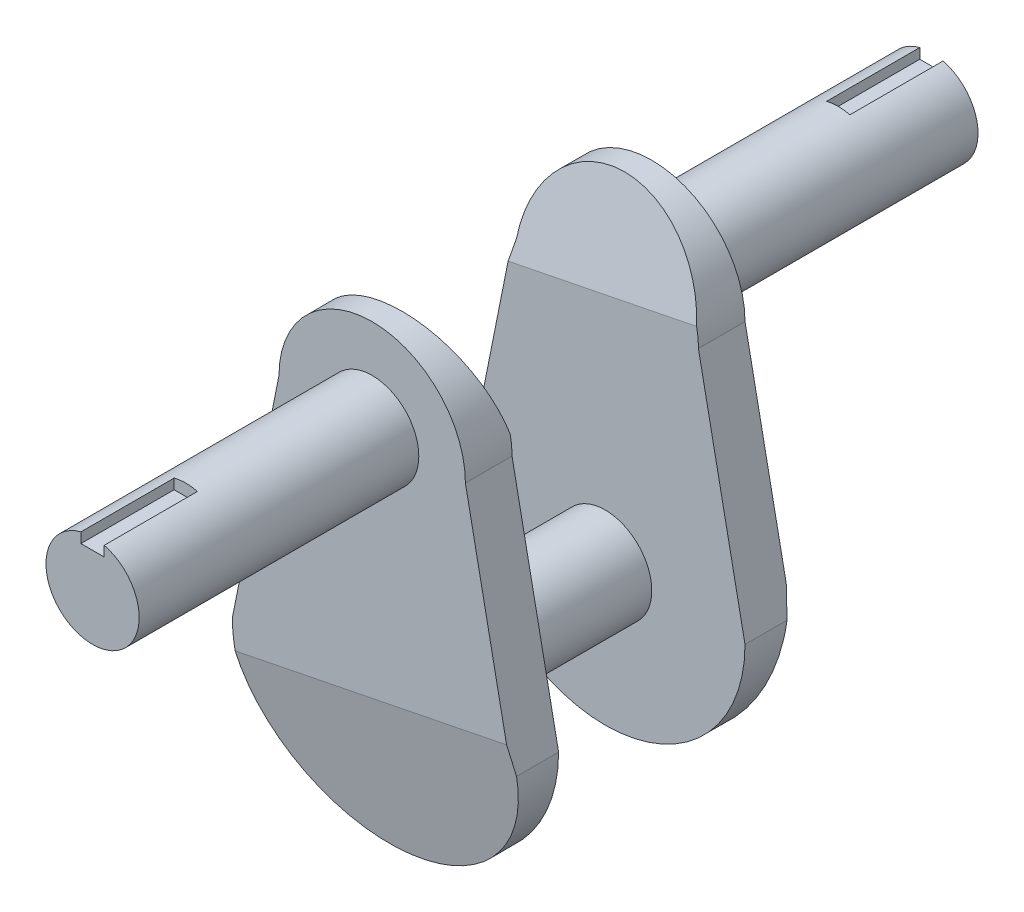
SolidWorks part; units mm, degrees
other "Markup1"
sketch "Sketch19" plane through (-38.1, 88.9, -114.3) normal (-0.7048, 0.0144, -0.7093) x (-0.7094, -0.0113, 0.7047)
ref_plane "Front Plane" through (0, 0, 0) normal (0, 0, 1) x (1, 0, 0)
ref_plane "Top Plane" through (0, 0, 0) normal (0, 1, 0) x (1, 0, 0)
ref_plane "Right Plane" through (0, 0, 0) normal (1, 0, 0) x (0, 0, -1)
sketch "Sketch1" plane through (0, 0, 0) normal (0, 0, 1) x (1, 0, 0)
  circle A0 centre (0, 0) radius 12.7
  dimension "D1" = 25.4
extrude "Boss-Extrude1" add sketch "Sketch1" along normal blind 25.4
sketch "Sketch3" plane through (0, 0, 25.4) normal (0, 0, 1) x (1, 0, 0)
  line L0 (-25.4, 63.5) -> (-38.1, 0)
  line L1 (25.4, 63.5) -> (38.1, 0)
  arc A0 (-38.1, 0) -> (38.1, 0) centre (0, 0) ccw
  arc A1 (25.4, 63.5) -> (-25.4, 63.5) centre (0, 63.5) ccw
  dimension "D1" = 76.2
  dimension "D2" = 50.8
  dimension "D3" = 63.5
extrude "Boss-Extrude2" add sketch "Sketch3" along normal blind 12.7
sketch "Sketch5" plane through (0, 0, 38.1) normal (0, 0, 1) x (1, 0, 0)
  circle A0 centre (0, 63.5) radius 12.7
  arc A1 (25.4, 63.5) -> (-25.4, 63.5) centre (0, 63.5) ccw construction
  point P5 (0, 88.9)
  dimension "D1" = 25.4
  dimension "D2" = 25.4
extrude "Boss-Extrude3" add sketch "Sketch5" along normal blind 76.2
sketch "Sketch7" plane through (36.6346, 7.3269, 0) normal (0.9806, 0.1961, 0) x (0, 0, -1)
  line L0 (-38.1, -7.472) -> (-38.1, 57.2855) construction
  line L1 (-38.1, -38.1) -> (-25.4, -38.1) construction
  line L2 (-38.1, 0) -> (-31.75, -38.1)
  arc A0 (-38.1, 0) -> (-31.75, -38.1) centre (-34.925, -19.05) ccw
extrude "Cut-Extrude1" cut sketch "Sketch7" against normal through all
sketch "Sketch8" plane through (36.6346, 7.3269, 0) normal (0.9806, 0.1961, 0) x (0, 0, -1)
  line L0 (-25.4, 57.2855) -> (-25.4, 87.6669) construction
  line L1 (-25.4, 87.6669) -> (-38.1, 87.6669) construction
  line L2 (-31.75, 87.6669) -> (-25.4, 62.2669)
  arc A0 (-25.4, 62.2669) -> (-31.75, 87.6669) centre (-28.575, 74.9669) ccw
extrude "Cut-Extrude3" cut sketch "Sketch8" against normal through all and the other way through all
sketch "Sketch12" plane through (0, 0, 0) normal (0, 0, -1) x (-1, 0, 0)
  circle A0 centre (0, 0) radius 12.7
  dimension "D1" = 25.4
extrude "Boss-Extrude4" add sketch "Sketch12" along normal blind 25.4
sketch "Sketch13" plane through (0, 0, -25.4) normal (0, 0, -1) x (-1, 0, 0)
  line L0 (-25.4, 63.5) -> (-38.1, 0)
  line L1 (25.4, 63.5) -> (38.1, 0)
  arc A1 (25.4, 63.5) -> (-25.4, 63.5) centre (0, 63.5) ccw
  arc A2 (-38.1, 0) -> (38.1, 0) centre (0, 0) ccw
  dimension "D2" = 50.8
  dimension "D3" = 63.5
extrude "Boss-Extrude6" add sketch "Sketch13" along normal blind 12.7
sketch "Sketch14" plane through (0, 0, -38.1) normal (0, 0, -1) x (-1, 0, 0)
  circle A0 centre (0, 63.5) radius 12.7
  arc A1 (25.4, 63.5) -> (-25.4, 63.5) centre (0, 63.5) ccw construction
  point P5 (0, 88.9)
  dimension "D1" = 25.4
  dimension "D2" = 25.4
extrude "Boss-Extrude7" add sketch "Sketch14" along normal blind 76.2
sketch "Sketch15" plane through (36.6346, 7.3269, 0) normal (0.9806, 0.1961, 0) x (0, 0, -1)
  line L0 (38.1, 57.2855) -> (38.1, -7.472) construction
  line L1 (25.4, -38.1) -> (38.1, -38.1) construction
  line L2 (38.1, 0) -> (31.75, -38.1)
  arc A0 (38.1, 0) -> (31.75, -38.1) centre (34.925, -19.05) cw
extrude "Cut-Extrude4" cut sketch "Sketch15" against normal through all and the other way through all
sketch "Sketch16" plane through (36.6346, 7.3269, 0) normal (0.9806, 0.1961, 0) x (0, 0, -1)
  line L0 (25.4, 87.6669) -> (25.4, 57.2855) construction
  line L1 (38.1, 87.6669) -> (25.4, 87.6669) construction
  line L2 (31.75, 87.6669) -> (25.4, 62.2669)
  arc A0 (25.4, 62.2669) -> (31.75, 87.6669) centre (28.575, 74.9669) cw
extrude "Cut-Extrude5" cut sketch "Sketch16" against normal through all and the other way through all
sketch "Sketch17" plane through (0, 0, -114.3) normal (0, 0, -1) x (-1, 0, 0)
  line L1 (-3.175, 79.375) -> (3.175, 79.375)
  line L2 (-3.175, 79.375) -> (-3.175, 73.025)
  line L3 (-3.175, 73.025) -> (3.175, 73.025)
  line L4 (3.175, 79.375) -> (3.175, 73.025)
  line L5 (-3.175, 79.375) -> (3.175, 73.025) construction
  line L6 (-3.175, 73.025) -> (3.175, 79.375) construction
  circle A0 centre (0, 63.5) radius 12.7 construction
  point P0 (0, 76.2)
  dimension "D1" = 6.35
  dimension "D2" = 6.35
extrude "Cut-Extrude6" cut sketch "Sketch17" against normal blind 25.4
sketch "Sketch18" plane through (0, 0, 114.3) normal (0, 0, 1) x (1, 0, 0)
  line L1 (-3.175, 79.375) -> (3.175, 79.375)
  line L2 (-3.175, 79.375) -> (-3.175, 73.025)
  line L3 (-3.175, 73.025) -> (3.175, 73.025)
  line L4 (3.175, 79.375) -> (3.175, 73.025)
  line L5 (-3.175, 79.375) -> (3.175, 73.025) construction
  line L6 (-3.175, 73.025) -> (3.175, 79.375) construction
  circle A0 centre (0, 63.5) radius 12.7 construction
  circle A1 centre (0, 63.5) radius 12.7 construction
  point P0 (0, 76.2)
  dimension "D1" = 6.35
  dimension "D2" = 6.35
extrude "Cut-Extrude7" cut sketch "Sketch18" against normal blind 25.4
